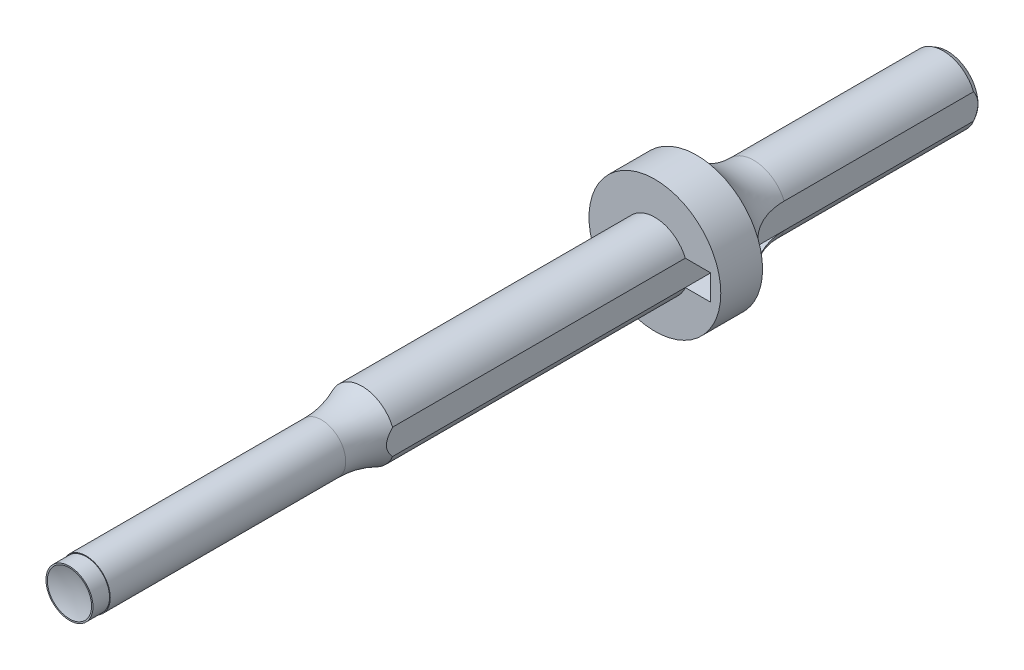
SolidWorks part; units mm, degrees
ref_plane "Front Plane" through (0, 0, 0) normal (0, 0, 1) x (1, 0, 0)
ref_plane "Top Plane" through (0, 0, 0) normal (0, 1, 0) x (1, 0, 0)
ref_plane "Right Plane" through (0, 0, 0) normal (1, 0, 0) x (0, 0, -1)
sketch "Sketch1" plane through (0, 0, 0) normal (0, 0, 1) x (1, 0, 0)
  circle A0 centre (0, 0) radius 4.765
  dimension "D1" = 9.53
extrude "Boss-Extrude1" add sketch "Sketch1" against normal blind 127
sketch "Sketch2" plane through (0, 0, 0) normal (0, 0, 1) x (1, 0, 0)
  circle A0 centre (0, 0) radius 3.5
  dimension "D1" = 7
extrude "Cut-Extrude1" cut sketch "Sketch2" against normal blind 42.333 flip side to cut
sketch "Sketch3" plane through (0, 0, 0) normal (0, 0, 1) x (1, 0, 0)
  circle A0 centre (0, 0) radius 3.4
  dimension "D1" = 6.8
extrude "Cut-Extrude2" cut sketch "Sketch3" against normal blind 2.4 flip side to cut
sketch "Sketch4" plane through (0, 0, 0) normal (1, 0, 0) x (0, 0, -1)
  line L0 (0, 0) -> (0, 3.2)
  line L1 (0, 3.4) -> (0, -3.4) construction
  line L2 (0.5533, 0) -> (0.5533, 3.2) construction
  line L3 (0, 0) -> (0.5533, 0)
  line L4 (0, 0) -> (0, -3.2) construction
  arc A0 (0.5533, 0) -> (0, 3.2) centre (-8.9767, 0) ccw
  dimension "D2" = 9.53
  dimension "D1" = 6.4
revolve "Cut-Revolve1" cut sketch "Sketch4" angle 360 about L3
chamfer "Chamfer1" distance 0.64 angle 30 1 edges at (4.765, 0, -127)
sketch "Sketch5" plane through (0, 0, 0) normal (1, 0, 0) x (0, 0, -1)
  line L0 (42.333, 0) -> (36.4537, 0)
  line L1 (42.333, 4.765) -> (42.333, -4.765) construction
  line L2 (36.4537, 0) -> (36.4537, 3.5)
  line L3 (42.333, 3.5) -> (2.4, 3.5) construction
  line L4 (42.333, 4.765) -> (42.333, 0)
  line L5 (36.4537, 3.5) -> (42.333, 3.5) construction
  arc A0 (36.4537, 3.5) -> (42.333, 4.765) centre (36.4537, 17.795) ccw
  dimension "D1" = 14.295
revolve "Revolve1" add sketch "Sketch5" angle 360 about L0
sketch "Sketch6" plane through (0, 0, 0) normal (1, 0, 0) x (0, 0, -1)
  line L0 (84.667, 0) -> (98.962, 0)
  line L1 (84.667, 0) -> (84.667, 9.53)
  line L2 (84.667, 9.53) -> (90.7088, 9.53)
  line L3 (98.962, 0) -> (98.962, 4.765)
  line L4 (126.36, 4.765) -> (42.333, 4.765) construction
  line L5 (98.962, 4.765) -> (84.667, 4.765) construction
  line L6 (127, -4.765) -> (127, 4.765) construction
  arc A0 (98.962, 4.765) -> (90.7088, 9.53) centre (98.962, 14.295) cw
  dimension "D2" = 9.53
  dimension "D1" = 42.333
  dimension "D3" = 14.295
revolve "Revolve2" add sketch "Sketch6" angle 360 about L0
sketch "Sketch7" plane through (0, 0, -127) normal (0, 0, -1) x (-1, 0, 0)
  line L9 (-8.0751, 1.8398) -> (-4.3955, 1.8398)
  line L10 (-8.0751, 1.8398) -> (-8.0751, -1.8398)
  line L11 (-8.0751, -1.8398) -> (-4.3955, -1.8398)
  line L12 (-4.3955, 1.8398) -> (-4.3955, -1.8398)
  circle A5 centre (0, 0) radius 4.765 construction
  circle A6 centre (0, 0) radius 4.3955 construction
  point P8 (-4.3955, 0)
extrude "Cut-Extrude3" cut sketch "Sketch7" against normal through all
